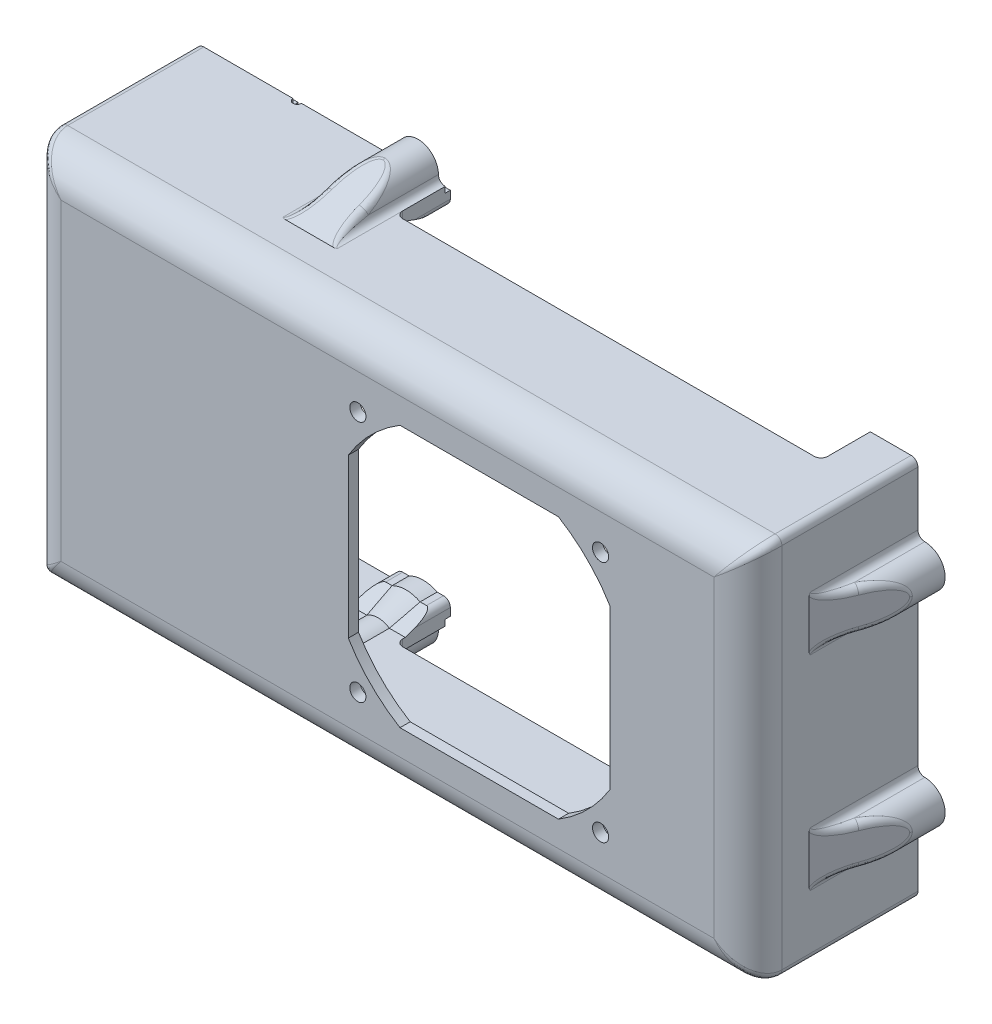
SolidWorks part; units mm, degrees
ref_plane "Alzado" through (0, 0, 0) normal (0, 0, 1) x (1, 0, 0)
ref_plane "Planta" through (0, 0, 0) normal (0, 1, 0) x (1, 0, 0)
ref_plane "Vista lateral" through (0, 0, 0) normal (1, 0, 0) x (0, 0, -1)
sketch "Croquis1" plane through (0, 0, 0) normal (0, 0, 1) x (1, 0, 0)
  line L0 (-96, -46) -> (96, 46) construction
  line L1 (-99, -49) -> (99, -49)
  line L2 (-99, -49) -> (-99, 49)
  line L3 (-99, 49) -> (99, 49)
  line L4 (99, -49) -> (99, 49)
  line L5 (-99, -49) -> (99, 49) construction
  line L6 (-99, 49) -> (99, -49) construction
  circle A0 centre (-96, 46) radius 1.75
  circle A1 centre (-96, -46) radius 1.75
  circle A2 centre (96, -46) radius 1.75
  circle A3 centre (96, 46) radius 1.75
  point P0 (0, 0)
  dimension "D3" = 192
  dimension "D4" = 92
  dimension "D5" = 3.5
  dimension "D1" = 98
  dimension "D2" = 198
sketch "Croquis2" plane through (0, 0, 0) normal (0, 0, 1) x (1, 0, 0)
  line L0 (106, -56) -> (106, -35.6569)
  line L1 (-106, 56) -> (-46.6569, 56)
  line L2 (-106, -56) -> (-106, -35.6569)
  line L3 (-106, -56) -> (-46.6569, -56)
  line L4 (-35.3431, -56) -> (106, -56)
  line L5 (-106, -24.3431) -> (-106, 24.3431)
  line L6 (-106, 35.6569) -> (-106, 56)
  line L7 (-35.3431, 56) -> (106, 56)
  line L8 (106, 35.6569) -> (106, 56)
  line L9 (106, -24.3431) -> (106, 24.3431)
  arc A0 (106, 24.3431) -> (106, 35.6569) centre (108, 30) ccw
  arc A1 (-35.3431, 56) -> (-46.6569, 56) centre (-41, 58) ccw
  arc A2 (-106, 35.6569) -> (-106, 24.3431) centre (-108, 30) ccw
  arc A3 (-106, -24.3431) -> (-106, -35.6569) centre (-108, -30) ccw
  arc A4 (-46.6569, -56) -> (-35.3431, -56) centre (-41, -58) ccw
  arc A5 (106, -35.6569) -> (106, -24.3431) centre (108, -30) ccw
sketch "Croquis3" plane through (0, 0, 0) normal (0, 0, 1) x (1, 0, 0)
  line L1 (106, -56) -> (-106, -56)
  line L2 (106, -56) -> (106, 56)
  line L3 (106, 56) -> (-106, 56)
  line L4 (-106, -56) -> (-106, 56)
  line L5 (106, -56) -> (-106, 56) construction
  line L6 (106, 56) -> (-106, -56) construction
  point P0 (0, 0)
extrude "Saliente-Extruir1" add sketch "Croquis3" along normal blind 50
sketch "Croquis8" plane through (0, 0, 0) normal (0, 0, 1) x (1, 0, 0)
  circle A0 centre (108, 30) radius 6
  circle A1 centre (108, -30) radius 6
  circle A2 centre (-41, -58) radius 6
  circle A3 centre (-41, 58) radius 6
  circle A4 centre (-108, 30) radius 6
  circle A5 centre (-108, -30) radius 6
extrude "Saliente-Extruir3" add sketch "Croquis8" along normal blind 10
sketch "Croquis9" plane through (0, 0, 10) normal (0, 0, 1) x (1, 0, 0)
  circle A1 centre (-41, 58) radius 6
  circle A2 centre (-41, 58) radius 6
  circle A3 centre (-41, -58) radius 6
  circle A4 centre (-41, -58) radius 6
  circle A5 centre (108, -30) radius 6
  circle A6 centre (108, -30) radius 6
  circle A7 centre (108, 30) radius 6
  circle A8 centre (108, 30) radius 6
  circle A9 centre (-108, -30) radius 6
  circle A10 centre (-108, -30) radius 6
  circle A11 centre (-108, 30) radius 6
  circle A12 centre (-108, 30) radius 6
  dimension "D1" = 0
  dimension "D2" = 0
  dimension "D3" = 0
  dimension "D4" = 0
  dimension "D5" = 0
  dimension "D6" = 0
chamfer "Chaflán1" distance 8 angle 70 6 edges at (106, -30, 10) (-41, -56, 10) (-106, -30, 10) (-106, 30, 10) (-41, 56, 10) (106, 30, 10)
sketch "Croquis4" plane through (0, 0, 0) normal (0, 0, 1) x (1, 0, 0)
  line L0 (-35.3431, 56) -> (106, 56) construction
  line L1 (-103, -53) -> (-44.3166, -53)
  line L2 (-103, -53) -> (-103, -33.3166)
  line L3 (-103, 53) -> (-44.3166, 53)
  line L4 (103, -53) -> (103, -33.3166)
  line L5 (-103, -53) -> (103, 53) construction
  line L6 (-103, 53) -> (103, -53) construction
  line L7 (106, 35.6569) -> (106, 56) construction
  line L8 (103, -26.6834) -> (103, 26.6834)
  line L9 (103, 33.3166) -> (103, 53)
  line L10 (-37.6834, 53) -> (103, 53)
  line L11 (-103, 33.3166) -> (-103, 53)
  line L12 (-103, -26.6834) -> (-103, 26.6834)
  line L13 (-37.6834, -53) -> (103, -53)
  circle A1 centre (-41, 58) radius 6
  arc A2 (-44.3166, 53) -> (-37.6834, 53) centre (-41, 58) ccw
  circle A3 centre (-41, -58) radius 6
  arc A4 (-37.6834, -53) -> (-44.3166, -53) centre (-41, -58) ccw
  circle A5 centre (108, -30) radius 6
  arc A6 (103, -26.6834) -> (103, -33.3166) centre (108, -30) ccw
  circle A7 centre (108, 30) radius 6
  arc A8 (103, 33.3166) -> (103, 26.6834) centre (108, 30) ccw
  circle A9 centre (-108, -30) radius 6
  arc A10 (-103, -33.3166) -> (-103, -26.6834) centre (-108, -30) ccw
  circle A11 centre (-108, 30) radius 6
  arc A12 (-103, 26.6834) -> (-103, 33.3166) centre (-108, 30) ccw
  point P0 (0, 0)
  dimension "D1" = 3
  dimension "D2" = 3
  dimension "D3" = 0
  dimension "D4" = 0
  dimension "D5" = 0
  dimension "D6" = 0
  dimension "D7" = 0
  dimension "D8" = 0
extrude "Cortar-Extruir1" cut sketch "Croquis4" along normal blind 47
fillet "Redondeo3" radius 2 20 edges at (-103, -53, 23.5) (-35.3431, -56, 15.9899) (-46.6569, -56, 15.9899) (103, -53, 23.5) (106, -24.3431, 15.9899) (106, -35.6569, 15.9899) (106, -56, 25) (103, 53, 23.5) (106, 35.6569, 15.9899) (106, 24.3431, 15.9899) (106, 56, 25) (-46.6569, 56, 15.9899) (-35.3431, 56, 15.9899) (-106, 56, 25) (-106, 24.3431, 15.9899) (-106, 35.6569, 15.9899) (-106, -35.6569, 15.9899) (-106, -24.3431, 15.9899) (-106, -56, 25) (-103, 53, 23.5)
sketch "Croquis13" plane through (0, 0, 0) normal (0, 0, 1) x (1, 0, 0)
  line L10 (-104.25, 51) -> (-104.25, 32.9155)
  line L11 (-104.25, 27.0845) -> (-104.25, -27.0845)
  line L12 (-104.25, -32.9155) -> (-104.25, -51)
  line L13 (-101, -54.25) -> (-43.9155, -54.25)
  line L14 (-38.0845, -54.25) -> (101, -54.25)
  line L15 (104.25, -51) -> (104.25, -32.9155)
  line L16 (104.25, -27.0845) -> (104.25, 27.0845)
  line L17 (104.25, 32.9155) -> (104.25, 51)
  line L18 (101, 54.25) -> (-38.0845, 54.25)
  line L19 (-43.9155, 54.25) -> (-101, 54.25)
  line L30 (-103, 51) -> (-103, 33.3166)
  line L31 (-44.3166, 53) -> (-101, 53)
  line L32 (101, 53) -> (-37.6834, 53)
  line L33 (103, 33.3166) -> (103, 51)
  line L34 (103, -26.6834) -> (103, 26.6834)
  line L35 (103, -51) -> (103, -33.3166)
  line L36 (-37.6834, -53) -> (101, -53)
  line L37 (-101, -53) -> (-44.3166, -53)
  line L38 (-103, -33.3166) -> (-103, -51)
  line L39 (-103, 26.6834) -> (-103, -26.6834)
  line L40 (-103, 51) -> (-103, 33.3166)
  line L41 (-44.3166, 53) -> (-101, 53)
  line L42 (101, 53) -> (-37.6834, 53)
  line L43 (103, 33.3166) -> (103, 51)
  line L44 (103, -26.6834) -> (103, 26.6834)
  line L45 (103, -51) -> (103, -33.3166)
  line L46 (-37.6834, -53) -> (101, -53)
  line L47 (-101, -53) -> (-44.3166, -53)
  line L48 (-103, -33.3166) -> (-103, -51)
  line L49 (-103, 26.6834) -> (-103, -26.6834)
  arc A10 (-104.25, 27.0845) -> (-104.25, 32.9155) centre (-108, 30) ccw
  arc A11 (-104.25, -32.9155) -> (-104.25, -27.0845) centre (-108, -30) ccw
  arc A12 (-104.25, -51) -> (-101, -54.25) centre (-101, -51) ccw
  arc A13 (-38.0845, -54.25) -> (-43.9155, -54.25) centre (-41, -58) ccw
  arc A14 (101, -54.25) -> (104.25, -51) centre (101, -51) ccw
  arc A15 (104.25, -27.0845) -> (104.25, -32.9155) centre (108, -30) ccw
  arc A16 (104.25, 32.9155) -> (104.25, 27.0845) centre (108, 30) ccw
  arc A17 (104.25, 51) -> (101, 54.25) centre (101, 51) ccw
  arc A18 (-43.9155, 54.25) -> (-38.0845, 54.25) centre (-41, 58) ccw
  arc A19 (-101, 54.25) -> (-104.25, 51) centre (-101, 51) ccw
  arc A30 (-101, 53) -> (-103, 51) centre (-101, 51) ccw
  arc A31 (-44.3166, 53) -> (-37.6834, 53) centre (-41, 58) ccw
  arc A32 (103, 51) -> (101, 53) centre (101, 51) ccw
  arc A33 (103, 33.3166) -> (103, 26.6834) centre (108, 30) ccw
  arc A34 (103, -26.6834) -> (103, -33.3166) centre (108, -30) ccw
  arc A35 (101, -53) -> (103, -51) centre (101, -51) ccw
  arc A36 (-37.6834, -53) -> (-44.3166, -53) centre (-41, -58) ccw
  arc A37 (-103, -51) -> (-101, -53) centre (-101, -51) ccw
  arc A38 (-103, -33.3166) -> (-103, -26.6834) centre (-108, -30) ccw
  arc A39 (-103, 26.6834) -> (-103, 33.3166) centre (-108, 30) ccw
  arc A40 (-101, 53) -> (-103, 51) centre (-101, 51) ccw
  arc A41 (-44.3166, 53) -> (-37.6834, 53) centre (-41, 58) ccw
  arc A42 (103, 51) -> (101, 53) centre (101, 51) ccw
  arc A43 (103, 33.3166) -> (103, 26.6834) centre (108, 30) ccw
  arc A44 (103, -26.6834) -> (103, -33.3166) centre (108, -30) ccw
  arc A45 (101, -53) -> (103, -51) centre (101, -51) ccw
  arc A46 (-37.6834, -53) -> (-44.3166, -53) centre (-41, -58) ccw
  arc A47 (-103, -51) -> (-101, -53) centre (-101, -51) ccw
  arc A48 (-103, -33.3166) -> (-103, -26.6834) centre (-108, -30) ccw
  arc A49 (-103, 26.6834) -> (-103, 33.3166) centre (-108, 30) ccw
  dimension "D1" = 0
  dimension "D2" = 1.25
extrude "Saliente-Extruir5" add sketch "Croquis13" against normal blind 1.5
sketch "Croquis15" plane through (0, 0, 0) normal (0, 0, 1) x (1, 0, 0)
  line L2 (-33, 56) -> (92, 56)
  line L3 (-33, 56) -> (-33, 53)
  line L4 (-33, 53) -> (92, 53)
  line L5 (92, 56) -> (92, 53)
  line L7 (-104, -56) -> (104, -56) construction
  line L10 (-33, -56) -> (92, -56)
  line L11 (-33, -56) -> (-33, -53)
  line L12 (-33, -53) -> (92, -53)
  line L13 (92, -56) -> (92, -53)
  line L16 (-106, 14) -> (-103, 14)
  line L17 (-106, 14) -> (-106, -14)
  line L18 (-106, -14) -> (-103, -14)
  line L19 (-103, 14) -> (-103, -14)
  line L23 (104, 56) -> (-104, 56) construction
  line L25 (-106, 54) -> (-106, -54) construction
  line L26 (106, -54) -> (106, 54) construction
  dimension "D1" = 42
  dimension "D2" = 42
  dimension "D3" = 3
  dimension "D4" = 125
  dimension "D5" = 14
  dimension "D6" = 3
  dimension "D7" = 3
extrude "Cortar-Extruir2" cut sketch "Croquis15" along normal blind 14.5 and the other way up to next
fillet "Redondeo4" radius 2 6 edges at (-104.5, 14, 14.5) (-104.5, -14, 14.5) (-33, -54.5, 14.5) (92, -54.5, 14.5) (92, 54.5, 14.5) (-33, 54.5, 14.5)
sketch "Croquis16" plane through (0, 0, 0) normal (0, 0, -1) x (-1, 0, 0)
  circle A0 centre (108, -30) radius 1.15
  circle A1 centre (41, -58) radius 1.15
  circle A2 centre (-108, -30) radius 1.15
  circle A3 centre (-108, 30) radius 1.15
  circle A4 centre (41, 58) radius 1.15
  circle A5 centre (108, 30) radius 1.15
  dimension "D1" = 2.3
extrude "Cortar-Extruir3" cut sketch "Croquis16" against normal blind 10
sketch "Croquis17" plane through (0, 0, 50) normal (0, 0, 1) x (1, 0, 0)
  line L0 (99, -49) -> (99, 49) construction
  line L1 (65.5, -38.5) -> (-11.5, -38.5)
  line L2 (65.5, -38.5) -> (65.5, 38.5)
  line L3 (65.5, 38.5) -> (-11.5, 38.5)
  line L4 (-11.5, -38.5) -> (-11.5, 38.5)
  line L5 (65.5, -38.5) -> (-11.5, 38.5) construction
  line L6 (65.5, 38.5) -> (-11.5, -38.5) construction
  line L8 (62.685, -35.685) -> (-8.685, -35.685)
  line L9 (62.685, -35.685) -> (62.685, 35.685)
  line L10 (62.685, 35.685) -> (-8.685, 35.685)
  line L11 (-8.685, -35.685) -> (-8.685, 35.685)
  line L12 (62.685, -35.685) -> (-8.685, 35.685) construction
  line L13 (62.685, 35.685) -> (-8.685, -35.685) construction
  circle A0 centre (27, 0) radius 45
  point P0 (27, 0)
  dimension "D4" = 90
  dimension "D1" = 72
  dimension "D2" = 77
  dimension "D3" = 77
  dimension "D5" = 71.37
sketch "Croquis18" plane through (0, 0, 50) normal (0, 0, 1) x (1, 0, 0)
  line L0 (65.5, 38.5) -> (-11.5, 38.5) construction
  line L1 (65.5, -38.5) -> (65.5, 38.5) construction
  line L2 (65.5, -38.5) -> (-11.5, -38.5) construction
  line L3 (-11.5, -38.5) -> (-11.5, 38.5) construction
  line L4 (50.297, 38.5) -> (3.703, 38.5)
  line L5 (65.5, -23.297) -> (65.5, 23.297)
  line L6 (50.297, -38.5) -> (3.703, -38.5)
  line L7 (-11.5, -23.297) -> (-11.5, 23.297)
  circle A0 centre (-8.685, -35.685) radius 2.375
  circle A1 centre (-8.685, 35.685) radius 2.375
  circle A2 centre (62.685, 35.685) radius 2.375
  circle A3 centre (62.685, -35.685) radius 2.375
  circle A4 centre (27, 0) radius 45 construction
  arc A5 (-11.5, -23.297) -> (3.703, -38.5) centre (27, 0) ccw
  arc A6 (50.297, -38.5) -> (65.5, -23.297) centre (27, 0) ccw
  arc A7 (65.5, 23.297) -> (50.297, 38.5) centre (27, 0) ccw
  arc A8 (3.703, 38.5) -> (-11.5, 23.297) centre (27, 0) ccw
  dimension "D1" = 4.75
extrude "Cortar-Extruir4" cut sketch "Croquis18" against normal up to next
sketch "Croquis20" plane through (0, 56, 0) normal (0, 1, 0) x (1, 0, 0)
  line L1 (-49, 0) -> (-104, 0) construction
  line L2 (-75.25, 0) -> (-75.25, 1.5)
  line L3 (-43.9155, 1.5) -> (-101, 1.5) construction
  line L4 (-75.25, 1.5) -> (-77.75, 1.5)
  line L5 (-77.75, 1.5) -> (-77.75, 0)
  arc A0 (-77.75, 0) -> (-75.25, 0) centre (-76.5, 0) ccw
  dimension "D1" = 2.5
  dimension "D2" = 29.5
extrude "Cortar-Extruir5" cut sketch "Croquis20" against normal up to next
sketch "Croquis22" plane through (0, 0, 47) normal (0, 0, -1) x (-1, 0, 0)
  line L0 (44.3166, 53) -> (101, 53) construction
  line L1 (55.75, 53) -> (58.75, 53)
  line L2 (55.75, 53) -> (55.75, -53)
  line L3 (55.75, -53) -> (58.75, -53)
  line L4 (58.75, 53) -> (58.75, -53)
  line L5 (101, -53) -> (44.3166, -53) construction
  line L6 (103, 0) -> (11.5, 0) construction
  line L7 (103, -12) -> (103, 12) construction
  line L8 (11.5, -23.297) -> (11.5, 23.297) construction
  line L9 (58.75, 53) -> (55.75, -53) construction
  point P6 (57.25, 0)
  point P15 (0, 0)
  point P16 (0, 0)
  dimension "D1" = 3
extrude "Saliente-Extruir7" add sketch "Croquis22" along normal blind 9
fillet "Redondeo5" radius 10 16 edges at (105.4142, -55.4142, 50) (0, -56, 50) (-105.4142, -55.4142, 50) (-106, 0, 50) (-105.4142, 55.4142, 50) (0, 56, 50) (105.4142, 55.4142, 50) (106, 0, 50) (31.6583, -53, 47) (102.4142, -52.4142, 47) (102.4142, 52.4142, 47) (31.6583, 53, 47) (103, -42.1583, 47) (-102.4142, -52.4142, 47) (-102.4142, 52.4142, 47) (-103, -42.1583, 47)
fillet "Redondeo7" radius 2 6 edges at (-58.75, -49.7082, 44.4162) (-58.75, 49.7082, 44.4162) (-55.75, 49.7082, 44.4162) (-55.75, -49.7082, 44.4162) (-58.75, 0, 47) (-55.75, 0, 47)
fillet "Redondeo6" radius 2 24 edges at (106.5858, 36.5858, 30.3704) (112.2426, 34.2426, 14.8283) (106.5858, 23.4142, 30.3704) (106.5858, -23.4142, 30.3704) (112.2426, -25.7574, 14.8283) (106.5858, -36.5858, 30.3704) (-34.4142, -56.5858, 30.3704) (-36.7574, -62.2426, 14.8283) (-47.5858, -56.5858, 30.3704) (-106.5858, -36.5858, 30.3704) (-112.2426, -34.2426, 14.8283) (-106.5858, -23.4142, 30.3704) (-106.5858, 23.4142, 30.3704) (-112.2426, 25.7574, 14.8283) (-106.5858, 36.5858, 30.3704) (-47.5858, 56.5858, 30.3704) (-34.4142, 56.5858, 30.3704) (-36.7574, 62.2426, 14.8283) (112.2426, 25.7574, 14.8283) (112.2426, -34.2426, 14.8283) (-45.2426, -62.2426, 14.8283) (-112.2426, -25.7574, 14.8283) (-112.2426, 34.2426, 14.8283) (-45.2426, 62.2426, 14.8283)
sketch "Croquis21" plane through (0, 0, -1.5) normal (0, 0, -1) x (-1, 0, 0)
  line L0 (44.3166, 53) -> (101, 53) construction
  line L1 (-101, 53) -> (37.6834, 53) construction
  line L2 (44.3166, 53) -> (49, 53)
  line L3 (33, 53) -> (37.6834, 53)
  line L4 (35, 50) -> (36.8769, 50)
  line L5 (45.1231, 50) -> (47, 50)
  line L6 (33, 53) -> (33, 52)
  line L7 (33, 56) -> (33, 53) construction
  line L8 (49, 53) -> (49, 52)
  line L9 (37.6834, -53) -> (33, -53) construction
  line L10 (-101, 53) -> (37.6834, 53) construction
  line L11 (-101, 50) -> (36.8769, 50) construction
  line L12 (45.1231, 50) -> (101, 50) construction
  line L13 (44.3166, 53) -> (101, 53) construction
  line L14 (101, -53) -> (44.3166, -53) construction
  line L15 (37.6834, -53) -> (33, -53)
  line L16 (49, -53) -> (44.3166, -53)
  line L17 (47, -50) -> (45.1231, -50)
  line L18 (36.8769, -50) -> (35, -50)
  line L19 (49, 53) -> (49, -53) construction
  line L20 (33, 53) -> (33, -53) construction
  line L21 (49, -53) -> (49, -52)
  line L22 (33, -52) -> (33, -53)
  line L23 (101, -50) -> (45.1231, -50) construction
  line L24 (101, -53) -> (44.3166, -53) construction
  line L25 (36.8769, -50) -> (33, -50) construction
  arc A0 (37.6834, 53) -> (44.3166, 53) centre (41, 58) ccw construction
  arc A1 (37.6834, 53) -> (44.3166, 53) centre (41, 58) ccw
  arc A2 (36.8769, 50) -> (45.1231, 50) centre (41, 58) ccw
  arc A3 (49, 52) -> (47, 50) centre (47, 52) cw
  arc A4 (33, 52) -> (35, 50) centre (35, 52) ccw
  arc A5 (44.3166, -53) -> (37.6834, -53) centre (41, -58) ccw construction
  arc A6 (44.3166, -53) -> (37.6834, -53) centre (41, -58) ccw
  arc A7 (45.1231, -50) -> (36.8769, -50) centre (41, -58) ccw
  arc A8 (35, -50) -> (33, -52) centre (35, -52) ccw
  arc A9 (49, -52) -> (47, -50) centre (47, -52) ccw
  point P38 (49, -50)
  dimension "D2" = 2
  dimension "D4" = 2
  dimension "D1" = 3
  dimension "D3" = 3
extrude "Saliente-Extruir6" add sketch "Croquis21" against normal blind 5
chamfer "Chaflán4" distance 3 angle 70 6 edges at (-35.3417, 53, 3.5) (-41, 52, 3.5) (-46.6583, 53, 3.5) (-35.3417, -53, 3.5) (-41, -52, 3.5) (-46.6583, -53, 3.5)
